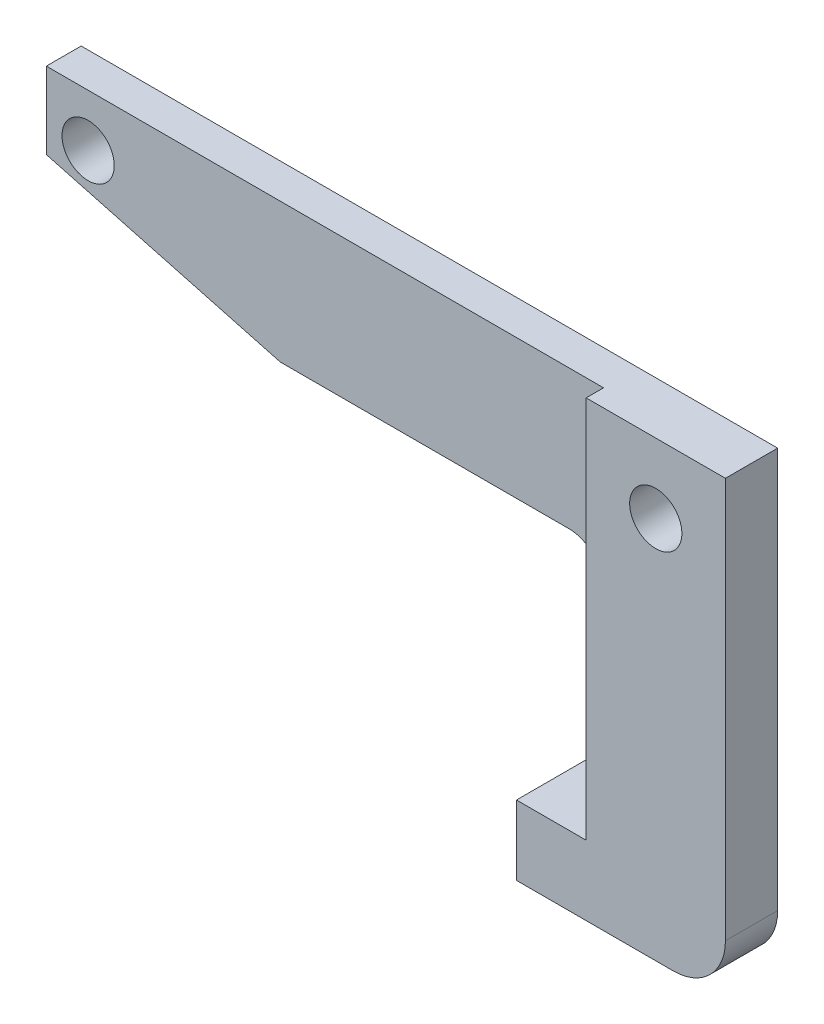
SolidWorks part; units mm, degrees
ref_plane "Front" through (0, 0, 0) normal (0, 0, 1) x (1, 0, 0)
ref_plane "Top" through (0, 0, 0) normal (0, 1, 0) x (1, 0, 0)
ref_plane "Right" through (0, 0, 0) normal (1, 0, 0) x (0, 0, -1)
sketch "Sketch1" plane through (0, 0, 0) normal (0, 0, 1) x (1, 0, 0)
  line L1 (-114.3, 12.7) -> (12.7, 12.7)
  line L2 (-114.3, 12.7) -> (-114.3, -12.7)
  line L3 (-114.3, -12.7) -> (-12.7, -12.7)
  line L4 (12.7, 12.7) -> (12.7, -69.85)
  line L6 (-12.7, -12.7) -> (-12.7, -57.15)
  line L9 (-12.7, -57.15) -> (-25.4, -57.15)
  line L11 (12.7, -69.85) -> (-25.4, -69.85)
  line L12 (-25.4, -57.15) -> (-25.4, -69.85)
  dimension "D1" = 25.4
  dimension "D2" = 127
  dimension "D3" = 44.45
  dimension "D4" = 82.55
  dimension "D5" = 12.7
  dimension "D6" = 12.7
  dimension "D7" = 38.1
  dimension "D8" = 25.4
extrude "Base-Extrude" add sketch "Sketch1" along normal blind 12.7
sketch "Sketch2" plane through (0, 0, 12.7) normal (0, 0, 1) x (1, 0, 0)
  circle A0 centre (0, 0) radius 4.7625
  dimension "D1" = 9.525
extrude "Cut-Extrude1" cut sketch "Sketch2" against normal through all
sketch "Sketch3" plane through (0, 0, 12.7) normal (0, 0, 1) x (1, 0, 0)
  line L1 (12.7, 12.7) -> (-114.3, 12.7) construction
  line L2 (-114.3, 12.7) -> (-114.3, -12.7) construction
  circle A0 centre (-106.68, 3.175) radius 4.7625
  dimension "D1" = 9.525
  dimension "D2" = 9.525
  dimension "D3" = 7.62
extrude "Cut-Extrude2" cut sketch "Sketch3" against normal through all
chamfer "Chamfer1" distance 11.43 angle 75 1 edges at (-114.3, -12.7, 6.35)
sketch "Sketch4" plane through (0, 0, 12.7) normal (0, 0, 1) x (1, 0, 0)
  line L1 (-12.7, -12.7) -> (-114.3, -12.7)
  line L2 (-12.7, -12.7) -> (-12.7, 12.7)
  line L3 (-12.7, 12.7) -> (-114.3, 12.7)
  line L4 (-114.3, -12.7) -> (-114.3, 12.7)
extrude "Cut-Extrude3" cut sketch "Sketch4" against normal blind 3.175
fillet "Fillet1" radius 9.525 1 edges at (12.7, -69.85, 6.35)
fillet "Fillet2" radius 6.35 1 edges at (-12.7, -12.7, 4.7625)
chamfer "Chamfer2" distance 3.175 angle 45 4 edges at (12.7, -23.8125, 0) (9.9102, -67.0602, 0) (-50.8, 12.7, 0) (-11.1125, -69.85, 0)
sketch "Sketch5" plane through (0, 0, 0) normal (0, 0, -1) x (-1, 0, 0)
  circle A0 centre (0, 0) radius 9.525
  dimension "D1" = 19.05
extrude "Cut-Extrude4" cut sketch "Sketch5" against normal blind 4.445
